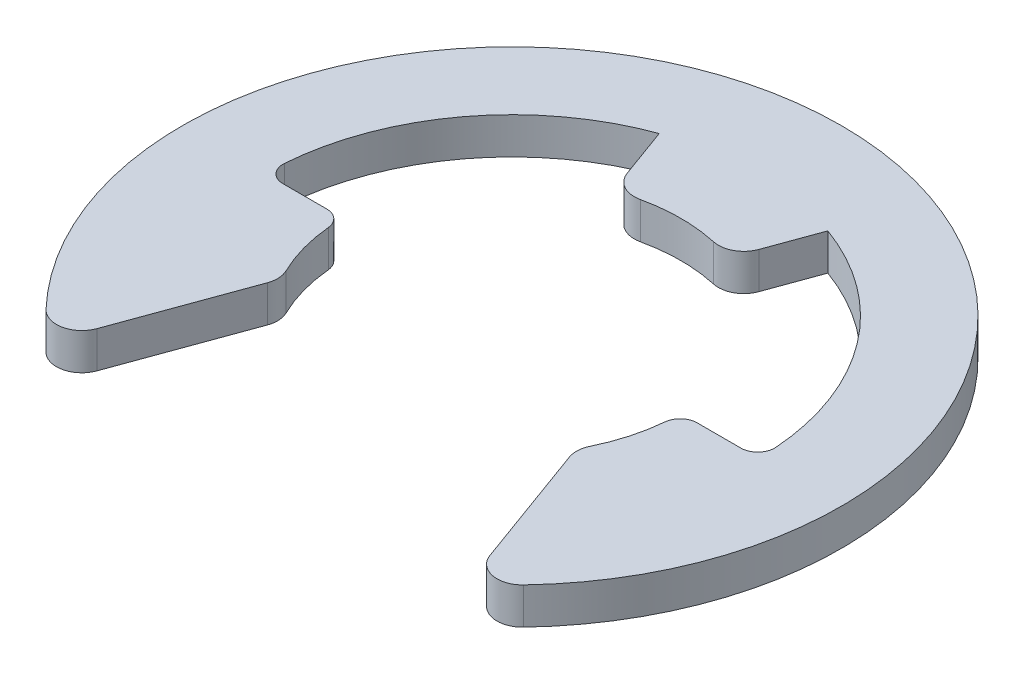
SolidWorks part; units mm, degrees
ref_plane "Front Plane" through (0, 0, 0) normal (0, 0, 1) x (1, 0, 0)
ref_plane "Top Plane" through (0, 0, 0) normal (0, 1, 0) x (1, 0, 0)
ref_plane "Right Plane" through (0, 0, 0) normal (1, 0, 0) x (0, 0, -1)
sketch "Sketch2" plane through (0, 0, 0) normal (0, 1, 0) x (1, 0, 0)
  line L0 (-7.4385, -9.031) -> (-5.225, -2.9495)
  line L2 (5.225, -2.9495) -> (7.4385, -9.031)
  line L4 (-6, 0) -> (-8.75, 0)
  line L5 (6, 0) -> (8.75, 0)
  line L6 (-2.9927, 8.2223) -> (-2.0521, 5.6382)
  line L8 (2.0521, 5.6382) -> (2.9927, 8.2223)
  arc A0 (7.4385, -9.031) -> (-7.4385, -9.031) centre (0, 0) ccw
  arc A1 (5.225, -2.9495) -> (6, 0) centre (0, 0) ccw
  arc A2 (8.75, 0) -> (2.9927, 8.2223) centre (0, 0) ccw
  arc A3 (-6, 0) -> (-5.225, -2.9495) centre (0, 0) ccw
  arc A4 (2.0521, 5.6382) -> (-2.0521, 5.6382) centre (0, 0) ccw
  arc A5 (-2.9927, 8.2223) -> (-8.75, 0) centre (0, 0) ccw
  point P15 (0, 0)
  point P16 (0, 6)
  dimension "D1" = 23.4
  dimension "D2" = 12
  dimension "D3" = 17.5
  dimension "D4" = 70
  dimension "D5" = 70
  dimension "D6" = 10.45
  dimension "D7" = 40
extrude "Boss-Extrude1" add sketch "Sketch2" along normal mid plane 1.3
fillet "Fillet1" radius 0.9 6 edges at (5.225, 0, 2.9495) (-5.225, 0, 2.9495) (2.0521, 0, -5.6382) (-2.0521, 0, -5.6382) (7.4385, 0, 9.031) (-7.4385, 0, 9.031)
fillet "Fillet2" radius 0.6 4 edges at (8.75, 0, 0) (6, 0, 0) (-8.75, 0, 0) (-6, 0, 0)
